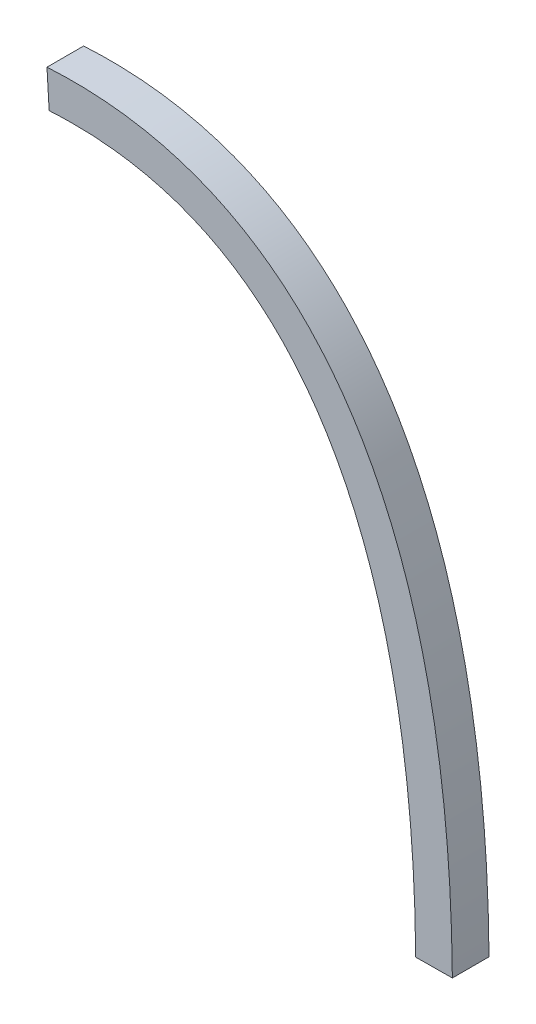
SolidWorks part; units mm, degrees
ref_plane "Plan de face" through (0, 0, 0) normal (0, 0, 1) x (1, 0, 0)
ref_plane "Plan de dessus" through (0, 0, 0) normal (0, 1, 0) x (1, 0, 0)
ref_plane "Plan de droite" through (0, 0, 0) normal (1, 0, 0) x (0, 0, -1)
sketch "Esquisse1" plane through (0, 0, 0) normal (0, 0, 1) x (1, 0, 0)
  spline S0 degree 3 poles (0, 0) (-0.4825, 59.4988) (-13.2979, 155.1653) (-100, 150) knots 0 0 0 0 1 1 1 1
  dimension "D1" = 100
  dimension "D2" = 150
  dimension "D3" = 75
  dimension "D4" = 9
  dimension "D5" = 120
  dimension "D6" = 30
extrude "Extru.-Mince1" add sketch "Esquisse1" along normal blind 10 thin
